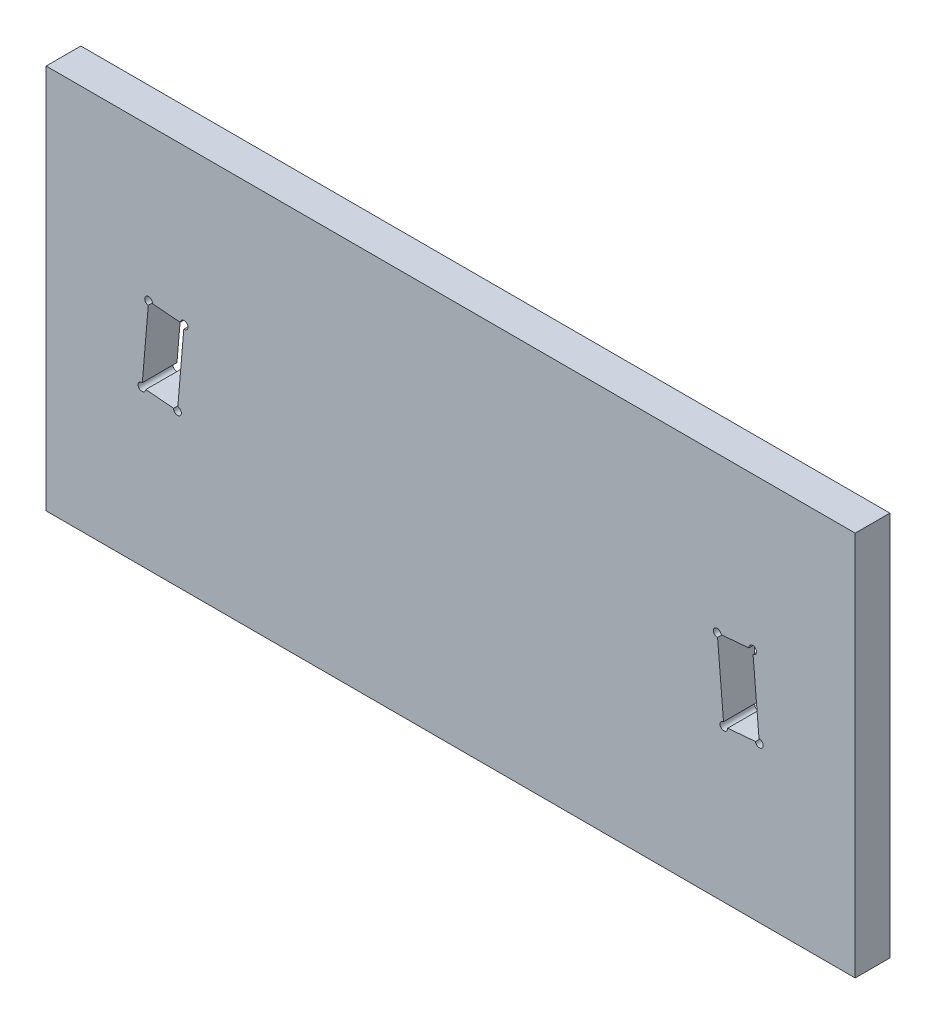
SolidWorks part; units mm, degrees
ref_plane "Front Plane" through (0, 0, 0) normal (0, 0, 1) x (1, 0, 0)
ref_plane "Top Plane" through (0, 0, 0) normal (0, 1, 0) x (1, 0, 0)
ref_plane "Right Plane" through (0, 0, 0) normal (1, 0, 0) x (0, 0, -1)
sketch "Sketch1" plane through (0, 0, 0) normal (0, 0, 1) x (1, 0, 0)
  line L0 (-228.5766, 515.2797) -> (191.4234, 515.2797)
  line L1 (128.8112, 437.8851) -> (133.0236, 388.4022) construction
  line L2 (121.5189, 414.4951) -> (139.9522, 416.0643) construction
  line L3 (-18.5766, 533.5213) -> (-18.5766, 305.5579) construction
  line L4 (119.8013, 434.6721) -> (138.2346, 436.2413)
  line L5 (138.2346, 436.2413) -> (141.6699, 395.8872)
  line L6 (141.6699, 395.8872) -> (123.2366, 394.318)
  line L7 (123.2366, 394.318) -> (119.8013, 434.6721)
  line L8 (191.4234, 515.2797) -> (191.4234, 315.2797)
  line L9 (191.4234, 315.2797) -> (-228.5766, 315.2797)
  line L10 (130.7356, 415.2797) -> (-167.8888, 415.2797) construction
  line L11 (-158.6721, 414.4951) -> (-177.1054, 416.0643) construction
  line L12 (-165.9644, 437.8851) -> (-170.1768, 388.4022) construction
  line L13 (-228.5766, 515.2797) -> (-228.5766, 315.2797)
  line L14 (-160.3898, 394.318) -> (-156.9545, 434.6721)
  line L15 (-178.8231, 395.8872) -> (-160.3898, 394.318)
  line L16 (-175.3878, 436.2413) -> (-178.8231, 395.8872)
  line L17 (-156.9545, 434.6721) -> (-175.3878, 436.2413)
  point P0 (130.7356, 415.2797)
  point P18 (-18.5766, 415.2797)
  point P23 (-18.5766, 315.2797)
  point P28 (-18.5766, 515.2797)
  dimension "D1" = 18.5
  dimension "D2" = 40.5
  dimension "D3" = 200
  dimension "D4" = 420
extrude "Boss-Extrude1" add sketch "Sketch1" along normal blind 18
sketch "Sketch2" plane through (0, 0, 18) normal (0, 0, 1) x (1, 0, 0)
  circle A0 centre (138.2346, 436.2413) radius 2
  circle A1 centre (119.8013, 434.6721) radius 2
  circle A2 centre (141.6699, 395.8872) radius 2
  circle A3 centre (123.2366, 394.318) radius 2
  circle A4 centre (-156.9545, 434.6721) radius 2
  circle A5 centre (-160.3898, 394.318) radius 2
  circle A6 centre (-175.3878, 436.2413) radius 2
  circle A7 centre (-178.8231, 395.8872) radius 2
  dimension "D1" = 4
extrude "Cut-Extrude1" cut sketch "Sketch2" against normal up to next
